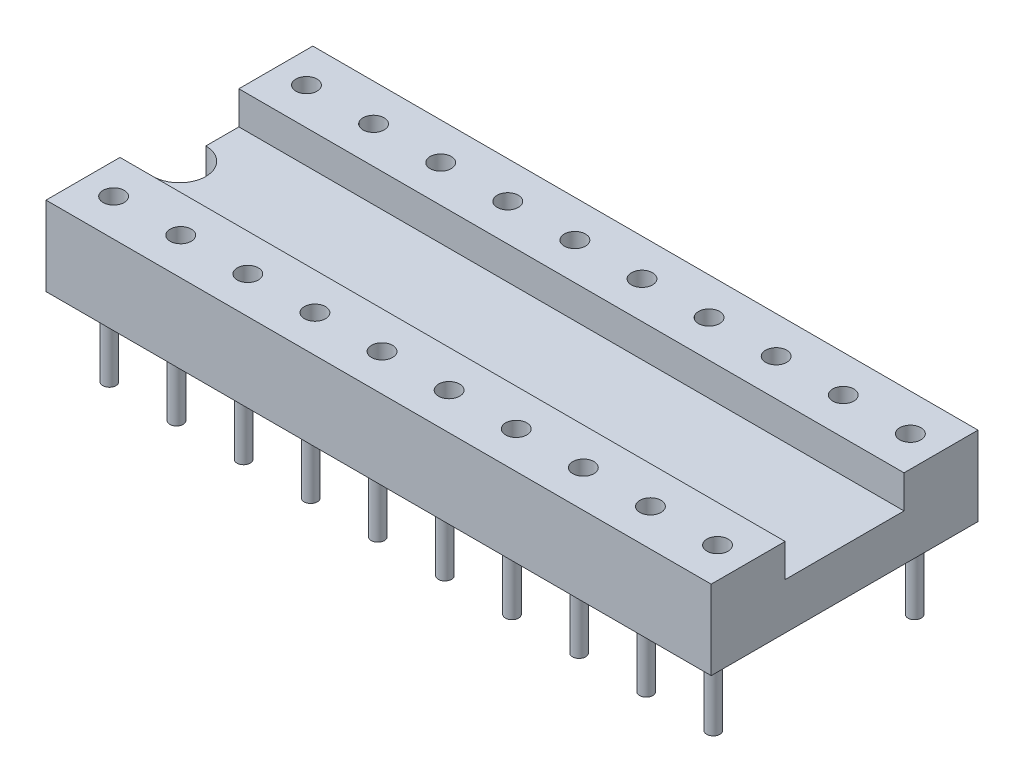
SolidWorks part; units mm, degrees
ref_plane "Plan de face" through (0, 0, 0) normal (0, 0, 1) x (1, 0, 0)
ref_plane "Plan de dessus" through (0, 0, 0) normal (0, 1, 0) x (1, 0, 0)
ref_plane "Plan de droite" through (0, 0, 0) normal (1, 0, 0) x (0, 0, -1)
sketch "Esquisse1" plane through (0, 0, 0) normal (1, 0, 0) x (0, 0, -1)
  line L0 (12.2051, 0) -> (-23.3437, 0) construction
  line L1 (0, -4.6214) -> (0, 25.9507) construction
  line L2 (-5.7968, 1.75) -> (2.763, 1.75) construction
  line L3 (5.7565, 3) -> (-6.8307, 3) construction
  line L4 (5.05, 3.8077) -> (5.05, -1.0493) construction
  line L5 (-5.05, 3.7235) -> (-5.05, -1.0493) construction
  line L6 (-2.25, 3.5071) -> (-2.25, 0.8142) construction
  line L7 (2.25, 3.5071) -> (2.25, 0.8142) construction
  line L8 (-2.25, 1.75) -> (-2.25, 3)
  line L9 (-2.25, 3) -> (-5.05, 3)
  line L10 (-5.05, 3) -> (-5.05, 0)
  line L11 (-5.05, 0) -> (5.05, 0)
  line L12 (5.05, 0) -> (5.05, 3)
  line L13 (5.05, 3) -> (2.25, 3)
  line L14 (2.25, 3) -> (2.25, 1.75)
  line L15 (2.25, 1.75) -> (-2.25, 1.75)
  dimension "D1" = 1.75
  dimension "D2" = 3
  dimension "D3" = 5.05
  dimension "D4" = 5.05
  dimension "D5" = 2.8
  dimension "D6" = 2.8
extrude "Extrusion1" add sketch "Esquisse1" along normal blind 25.18
sketch "Esquisse2" plane through (0, 1.75, 0) normal (0, 1, 0) x (-1, 0, 0)
  line L0 (0, -1) -> (0, 1)
  arc A0 (0, 1) -> (0, -1) centre (0, 0) ccw
extrude "Enlèv. mat.-Extru.1" cut sketch "Esquisse2" against normal through all
sketch "Esquisse3" plane through (0, 3, 0) normal (0, 1, 0) x (-1, 0, 0)
  line L0 (-13.1576, 5.05) -> (2.3638, 5.05) construction
  line L1 (0, 6.1465) -> (0, -6.3771) construction
  line L2 (1.5124, 0) -> (-12.9979, 0) construction
  line L3 (1.0512, 3.65) -> (-15.6055, 3.65) construction
  line L4 (-1.16, 6.2884) -> (-1.16, 1.7827) construction
  circle A0 centre (-1.16, 3.65) radius 0.4
  circle A1 centre (-1.16, -3.65) radius 0.4
  circle A2 centre (-3.7, 3.65) radius 0.4
  circle A3 centre (-3.7, -3.65) radius 0.4
  circle A4 centre (-6.24, 3.65) radius 0.4
  circle A5 centre (-6.24, -3.65) radius 0.4
  circle A6 centre (-8.78, 3.65) radius 0.4
  circle A7 centre (-8.78, -3.65) radius 0.4
  circle A8 centre (-11.32, 3.65) radius 0.4
  circle A9 centre (-11.32, -3.65) radius 0.4
  circle A10 centre (-13.86, 3.65) radius 0.4
  circle A11 centre (-13.86, -3.65) radius 0.4
  circle A12 centre (-16.4, 3.65) radius 0.4
  circle A13 centre (-16.4, -3.65) radius 0.4
  circle A14 centre (-18.94, 3.65) radius 0.4
  circle A15 centre (-18.94, -3.65) radius 0.4
  circle A16 centre (-21.48, 3.65) radius 0.4
  circle A17 centre (-21.48, -3.65) radius 0.4
  circle A18 centre (-24.02, 3.65) radius 0.4
  circle A19 centre (-24.02, -3.65) radius 0.4
  circle A28 centre (-26.56, 3.65) radius 0.4
  circle A29 centre (-26.56, -3.65) radius 0.4
  circle A30 centre (-29.1, 3.65) radius 0.4
  circle A31 centre (-29.1, -3.65) radius 0.4
  circle A32 centre (-31.64, 3.65) radius 0.4
  circle A33 centre (-31.64, -3.65) radius 0.4
  circle A34 centre (-34.18, 3.65) radius 0.4
  circle A35 centre (-34.18, -3.65) radius 0.4
  dimension "D1" = 1.4
  dimension "D2" = 1.16
extrude "Enlèv. mat.-Extru.2" cut sketch "Esquisse3" against normal blind 2.5
sketch "Esquisse5" plane through (0, 0, 0) normal (0, -1, 0) x (1, 0, 0)
  line L0 (-0.4263, 0) -> (10.6481, 0) construction
  line L1 (-0.4263, 3.81) -> (25.7669, 3.81) construction
  circle A0 centre (1.16, 3.81) radius 0.25
  circle A1 centre (1.16, -3.81) radius 0.25
  circle A2 centre (3.7, -3.81) radius 0.25
  circle A3 centre (3.7, 3.81) radius 0.25
  circle A4 centre (6.24, -3.81) radius 0.25
  circle A5 centre (6.24, 3.81) radius 0.25
  circle A6 centre (8.78, -3.81) radius 0.25
  circle A7 centre (8.78, 3.81) radius 0.25
  circle A8 centre (11.32, -3.81) radius 0.25
  circle A9 centre (11.32, 3.81) radius 0.25
  circle A10 centre (13.86, -3.81) radius 0.25
  circle A11 centre (13.86, 3.81) radius 0.25
  circle A12 centre (16.4, -3.81) radius 0.25
  circle A13 centre (16.4, 3.81) radius 0.25
  circle A14 centre (18.94, -3.81) radius 0.25
  circle A15 centre (18.94, 3.81) radius 0.25
  circle A16 centre (21.48, -3.81) radius 0.25
  circle A17 centre (21.48, 3.81) radius 0.25
  circle A18 centre (24.02, -3.81) radius 0.25
  circle A19 centre (24.02, 3.81) radius 0.25
  circle A28 centre (26.56, -3.81) radius 0.25
  circle A29 centre (26.56, 3.81) radius 0.25
  circle A30 centre (29.1, -3.81) radius 0.25
  circle A31 centre (29.1, 3.81) radius 0.25
  circle A32 centre (31.64, -3.81) radius 0.25
  circle A33 centre (31.64, 3.81) radius 0.25
  circle A34 centre (34.18, -3.81) radius 0.25
  circle A35 centre (34.18, 3.81) radius 0.25
  dimension "D1" = 14
  dimension "D2" = 3.81
extrude "Extrusion2" add sketch "Esquisse5" along normal blind 3
